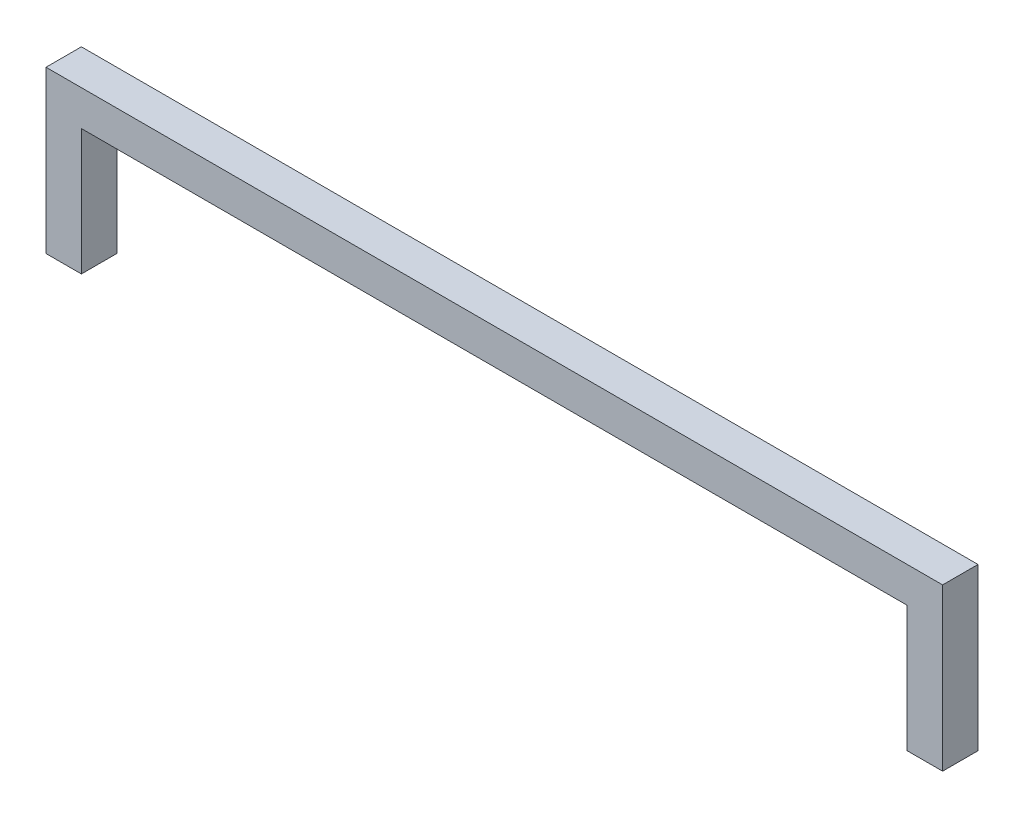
SolidWorks part; units mm, degrees
ref_plane "Piano frontale" through (0, 0, 0) normal (0, 0, 1) x (1, 0, 0)
ref_plane "Piano superiore" through (0, 0, 0) normal (0, 1, 0) x (1, 0, 0)
ref_plane "Piano destro" through (0, 0, 0) normal (1, 0, 0) x (0, 0, -1)
sketch "Schizzo1" plane through (0, 0, 0) normal (0, 0, 1) x (1, 0, 0)
  line L0 (0, 0) -> (0, 106.77)
  line L1 (0, 106.77) -> (700, 106.77)
  line L2 (700, 106.77) -> (700, 0)
  dimension "D1" = 106.77
  dimension "D2" = 700
sketch "Schizzo2" plane through (0, 0, 0) normal (0, 1, 0) x (1, 0, 0)
  line L1 (0, 0) -> (-30, 0)
  line L2 (0, 0) -> (0, -30)
  line L3 (0, -30) -> (-30, -30)
  line L4 (-30, 0) -> (-30, -30)
  dimension "D1" = 30
  dimension "D2" = 30
sweep "Sweep-Sottile1" add profiles "Schizzo2" path "Schizzo1" parameters "D1"=1
ref_plane "Piano1" through (350, 0, 0) normal (-1, 0, 0) x (0, 0, 1)
